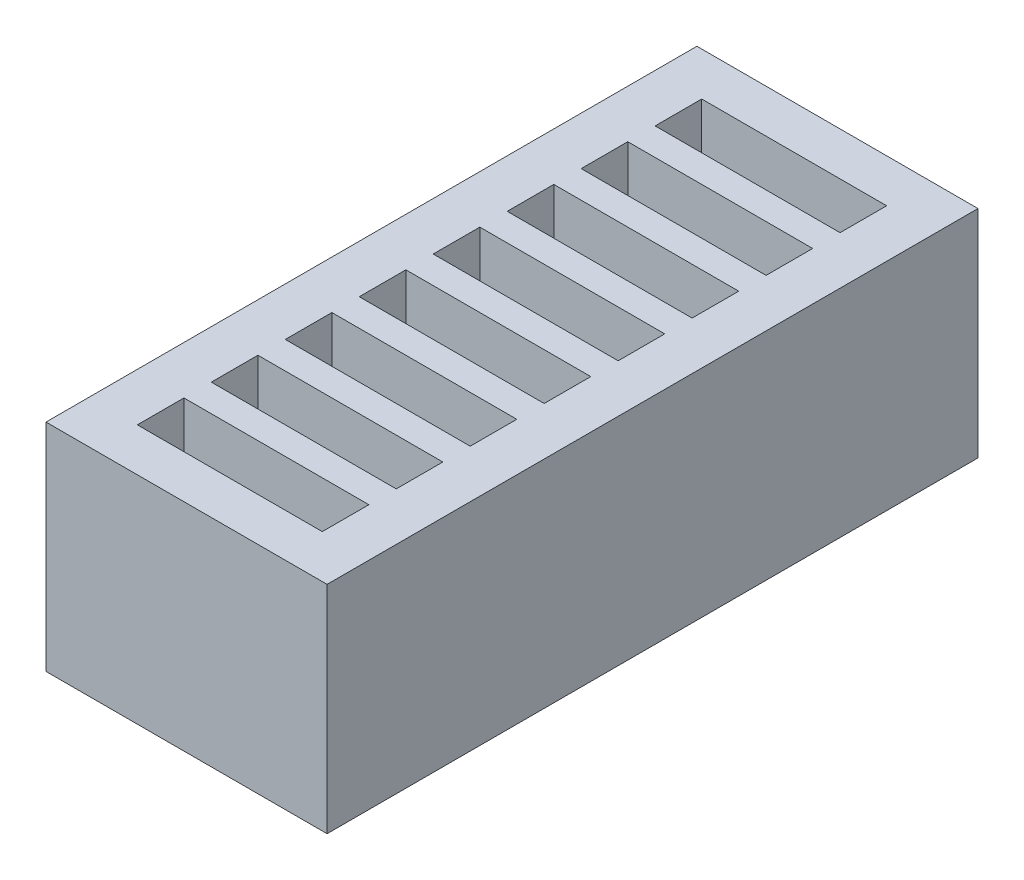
SolidWorks part; units mm, degrees
ref_plane "Front Plane" through (0, 0, 0) normal (0, 0, 1) x (1, 0, 0)
ref_plane "Top Plane" through (0, 0, 0) normal (0, 1, 0) x (1, 0, 0)
ref_plane "Right Plane" through (0, 0, 0) normal (1, 0, 0) x (0, 0, -1)
sketch "Sketch1" plane through (0, 0, 0) normal (0, 1, 0) x (1, 0, 0)
  line L1 (0, 0) -> (9.652, 0)
  line L2 (0, 0) -> (0, 22.352)
  line L3 (0, 22.352) -> (9.652, 22.352)
  line L4 (9.652, 0) -> (9.652, 22.352)
  dimension "D1" = 9.652
  dimension "D2" = 22.352
extrude "Extrude1" add sketch "Sketch1" along normal blind 7.4168
sketch "Sketch2" plane through (0, 7.4168, 0) normal (0, 1, 0) x (-1, 0, 0)
  line L0 (-4.826, 0) -> (-4.826, -22.352) construction
  line L1 (0, 0) -> (-9.652, 0) construction
  line L2 (-9.652, -22.352) -> (0, -22.352) construction
  line L3 (-9.652, -11.176) -> (0, -11.176) construction
  line L4 (-9.652, 0) -> (-9.652, -22.352) construction
  line L5 (0, -22.352) -> (0, 0) construction
  line L6 (-8.001, -6.5659) -> (-1.651, -6.5659)
  line L7 (-8.001, -9.1059) -> (-1.651, -9.1059)
  line L8 (-8.001, -9.1059) -> (-8.001, -10.7061)
  line L9 (-8.001, -10.7061) -> (-1.651, -10.7061)
  line L10 (-1.651, -9.1059) -> (-1.651, -10.7061)
  line L11 (-8.001, -6.5659) -> (-8.001, -8.1661)
  line L12 (-8.001, -8.1661) -> (-1.651, -8.1661)
  line L13 (-1.651, -6.5659) -> (-1.651, -8.1661)
  line L14 (-8.001, -4.0259) -> (-1.651, -4.0259)
  line L15 (-8.001, -4.0259) -> (-8.001, -5.6261)
  line L16 (-8.001, -5.6261) -> (-1.651, -5.6261)
  line L17 (-1.651, -4.0259) -> (-1.651, -5.6261)
  line L18 (-8.001, -1.4859) -> (-1.651, -1.4859)
  line L19 (-8.001, -1.4859) -> (-8.001, -3.0861)
  line L20 (-8.001, -3.0861) -> (-1.651, -3.0861)
  line L21 (-1.651, -1.4859) -> (-1.651, -3.0861)
  line L22 (-1.651, -20.8661) -> (-1.651, -19.2659)
  line L23 (-8.001, -19.2659) -> (-1.651, -19.2659)
  line L24 (-8.001, -20.8661) -> (-8.001, -19.2659)
  line L25 (-8.001, -20.8661) -> (-1.651, -20.8661)
  line L26 (-1.651, -18.3261) -> (-1.651, -16.7259)
  line L27 (-8.001, -16.7259) -> (-1.651, -16.7259)
  line L28 (-8.001, -18.3261) -> (-8.001, -16.7259)
  line L29 (-8.001, -18.3261) -> (-1.651, -18.3261)
  line L30 (-1.651, -15.7861) -> (-1.651, -14.1859)
  line L31 (-8.001, -14.1859) -> (-1.651, -14.1859)
  line L32 (-8.001, -15.7861) -> (-8.001, -14.1859)
  line L33 (-1.651, -13.2461) -> (-1.651, -11.6459)
  line L34 (-8.001, -11.6459) -> (-1.651, -11.6459)
  line L35 (-8.001, -13.2461) -> (-8.001, -11.6459)
  line L36 (-8.001, -13.2461) -> (-1.651, -13.2461)
  line L37 (-8.001, -15.7861) -> (-1.651, -15.7861)
  dimension "D1" = 6.35
  dimension "D2" = 3.175
  dimension "D3" = 1.6002
  dimension "D4" = 2.54
  dimension "D5" = 2.54
  dimension "D6" = 3.175
extrude "Cut-Extrude1" cut sketch "Sketch2" against normal blind 1.6002
sketch "Sketch3" plane through (0, 0, 0) normal (0, -1, 0) x (1, 0, 0)
  line L0 (4.826, 0) -> (4.826, -22.352) construction
  line L1 (0, 0) -> (9.652, 0) construction
  line L2 (9.652, -22.352) -> (0, -22.352) construction
  line L3 (0, -11.176) -> (9.652, -11.176) construction
  line L4 (0, -22.352) -> (0, 0) construction
  line L5 (9.652, 0) -> (9.652, -22.352) construction
  point P0 (1.016, -2.286)
  dimension "D1" = 7.62
  dimension "D2" = 17.78
